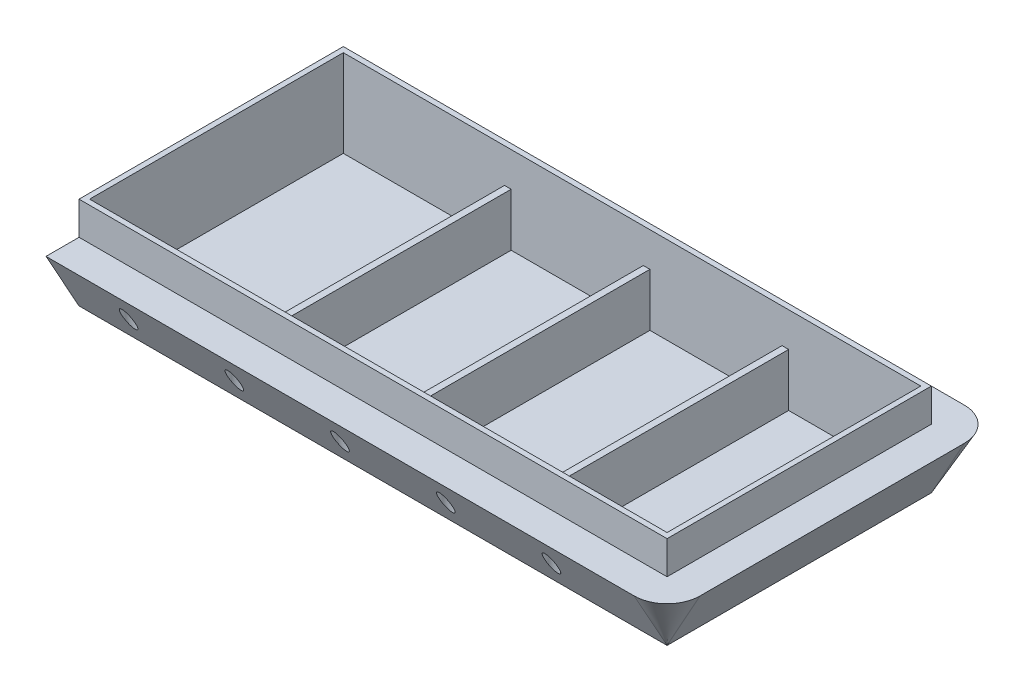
SolidWorks part; units mm, degrees
ref_plane "Front Plane" through (0, 0, 0) normal (0, 0, 1) x (1, 0, 0)
ref_plane "Top Plane" through (0, 0, 0) normal (0, 1, 0) x (1, 0, 0)
ref_plane "Right Plane" through (0, 0, 0) normal (1, 0, 0) x (0, 0, -1)
sketch "Sketch1" plane through (0, 0, 0) normal (0, 1, 0) x (1, 0, 0)
  line L0 (-218.5, 96) -> (218.5, 96)
  line L1 (-222.5, 100) -> (222.5, 100)
  line L2 (-222.5, 100) -> (-222.5, -100)
  line L3 (-222.5, -100) -> (222.5, -100)
  line L4 (222.5, 100) -> (222.5, -100)
  line L5 (-222.5, 100) -> (222.5, -100) construction
  line L6 (-222.5, -100) -> (222.5, 100) construction
  line L7 (218.5, 96) -> (218.5, -96)
  line L8 (-218.5, -96) -> (218.5, -96)
  line L9 (-218.5, 96) -> (-218.5, -96)
  point P0 (0, 0)
  dimension "D1" = 200
  dimension "D2" = 445
  dimension "D3" = 4
extrude "Boss-Extrude1" add sketch "Sketch1" along normal blind 70
sketch "Sketch2" plane through (0, 0, -96) normal (0, 0, 1) x (1, 0, 0)
  line L0 (222.5, 70) -> (222.5, 0) construction
  line L1 (-222.5, 0) -> (222.5, 0)
  line L2 (-222.5, 0) -> (-222.5, 4)
  line L3 (-222.5, 4) -> (222.5, 4)
  line L4 (222.5, 0) -> (222.5, 4)
  dimension "D1" = 4
extrude "Boss-Extrude2" add sketch "Sketch2" along normal up to surface (192 mm away)
ref_plane "Plane1" through (0, 45, 0) normal (0, 1, 0) x (1, 0, 0)
sketch "Sketch3" plane through (-222.5, 0, 0) normal (-1, 0, 0) x (0, 0, 1)
  line L0 (-100, 70) -> (100, 70) construction
  line L1 (100, 70) -> (100, 0) construction
  line L2 (110, 45) -> (-110, 45) construction
  line L3 (100, 45) -> (125, 45)
  line L4 (125, 45) -> (100, 0)
  line L6 (100, 0) -> (100, 45)
  point P0 (100.9234, 0)
  dimension "D1" = 25
  dimension "D2" = 25
extrude "Boss-Extrude3" add sketch "Sketch3" against normal up to surface (445 mm away)
mirror "Mirror1" about plane through (0, 0, 0) normal (0, 0, 1) of "Boss-Extrude3"
ref_plane "Plane2" through (0, 40, 0) normal (0, 1, 0) x (1, 0, 0)
sketch "Sketch4" plane through (0, 40, 0) normal (0, 1, 0) x (1, 0, 0)
  line L0 (-222.5, 112.5) -> (222.5, 112.5) construction
  line L1 (-222.5, 125) -> (-222.5, 100) construction
  line L2 (222.5, 100) -> (222.5, 125) construction
  line L3 (-38.5, 0) -> (38.5, 0) construction
  circle A0 centre (-172.5, 112.5) radius 5
  circle A1 centre (-92.5, 112.5) radius 5
  circle A2 centre (-12.5, 112.5) radius 5
  circle A3 centre (67.5, 112.5) radius 5
  circle A4 centre (147.5, 112.5) radius 5
  circle A5 centre (147.5, -112.5) radius 5
  circle A6 centre (67.5, -112.5) radius 5
  circle A7 centre (-12.5, -112.5) radius 5
  circle A8 centre (-172.5, -112.5) radius 5
  circle A9 centre (-92.5, -112.5) radius 5
  dimension "D2" = 10
  dimension "D1" = 50
  dimension "D3" = 5
extrude "Cut-Extrude1" cut sketch "Sketch4" against normal blind 30
sketch "Sketch5" plane through (0, 0, 100) normal (0, 0, 1) x (1, 0, 0)
  line L0 (222.5, 0) -> (222.5, 45)
  line L1 (222.5, 45) -> (247.5, 45)
  line L2 (247.5, 45) -> (222.5, 0)
  dimension "D1" = 25
extrude "Boss-Extrude4" add sketch "Sketch5" against normal up to surface (200 mm away)
ref_plane "Plane3" through (222.5, 45, 100) normal (0, -1, 0) x (-1, 0, 0)
sketch "Sketch7" plane through (222.5, 0, 0) normal (1, 0, 0) x (0, 0, -1)
  line L6 (-100, 0) -> (-100, 45)
  line L7 (-100, 45) -> (-125, 45)
  line L8 (-125, 45) -> (-100, 0)
  line L9 (-100, 0) -> (-100, 45)
  line L10 (-100, 45) -> (-125, 45)
  line L11 (-125, 45) -> (-100, 0)
  dimension "D1" = 0
revolve "Revolve1" add sketch "Sketch7" angle 360 about L9
mirror "Mirror2" about plane through (0, 0, 0) normal (0, 0, 1) of "Revolve1"
sketch "Sketch8" plane through (0, 70, 0) normal (0, 1, 0) x (1, 0, 0)
  line L0 (-218.5, -96) -> (218.5, -96) construction
  line L1 (218.5, 96) -> (168.5, 96)
  line L2 (218.5, 96) -> (218.5, -96)
  line L3 (218.5, -96) -> (168.5, -96)
  line L4 (168.5, 96) -> (168.5, -96)
  dimension "D1" = 50
extrude "Cut-Extrude2" cut sketch "Sketch8" against normal up to surface (66 mm away)
sketch "Sketch9" plane through (0, 4, 0) normal (0, 1, 0) x (1, 0, 0)
  line L0 (-218.5, 96) -> (218.5, 96) construction
  line L1 (113.5, 96) -> (118.5, 96)
  line L2 (113.5, 96) -> (113.5, -96)
  line L3 (113.5, -96) -> (118.5, -96)
  line L4 (118.5, 96) -> (118.5, -96)
  line L5 (-218.5, -96) -> (218.5, -96) construction
  line L6 (218.5, 96) -> (218.5, -96) construction
  line L7 (218.5, 96) -> (-218.5, 96) construction
  line L8 (8.5, 96) -> (13.5, 96)
  line L9 (8.5, 96) -> (8.5, -96)
  line L10 (8.5, -96) -> (13.5, -96)
  line L11 (13.5, 96) -> (13.5, -96)
  line L12 (-96.5, 96) -> (-91.5, 96)
  line L13 (-96.5, 96) -> (-96.5, -96)
  line L14 (-96.5, -96) -> (-91.5, -96)
  line L15 (-91.5, 96) -> (-91.5, -96)
  dimension "D1" = 5
  dimension "D2" = 100
  dimension "D3" = 5
  dimension "D4" = 100
  dimension "D5" = 5
  dimension "D6" = 100
extrude "Boss-Extrude5" add sketch "Sketch9" along normal blind 40
